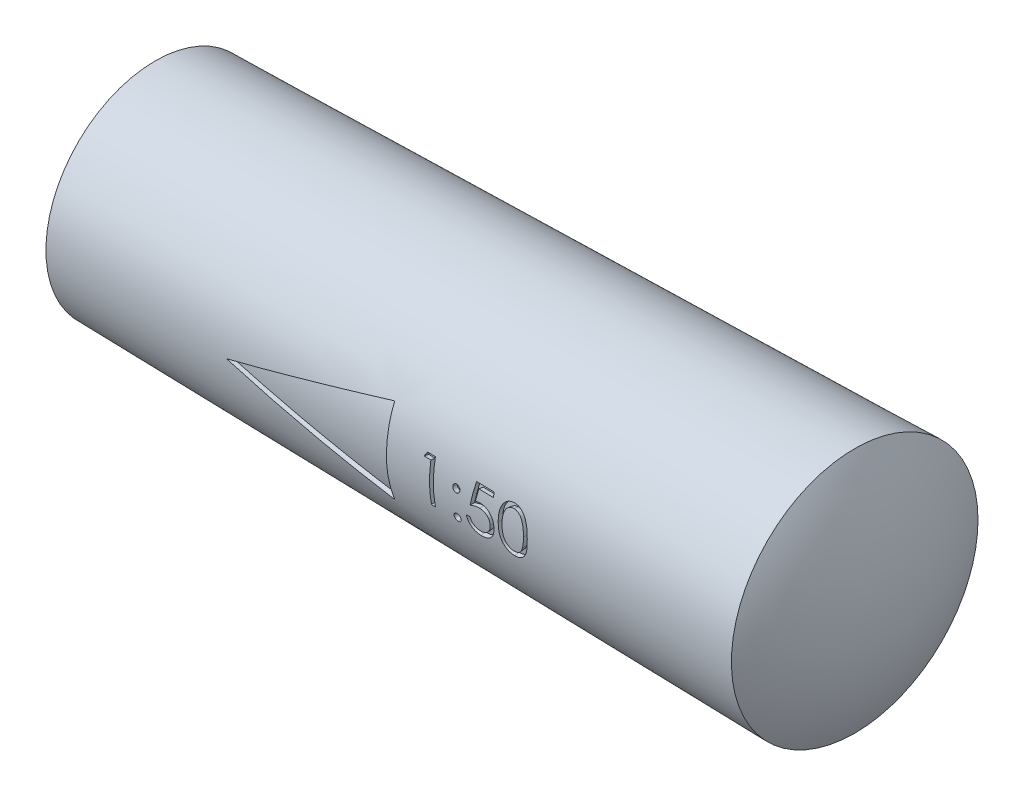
SolidWorks part; units mm, degrees
ref_plane "Front Plane" through (0, 0, 0) normal (0, 0, 1) x (1, 0, 0)
ref_plane "Top Plane" through (0, 0, 0) normal (0, 1, 0) x (1, 0, 0)
ref_plane "Right Plane" through (0, 0, 0) normal (1, 0, 0) x (0, 0, -1)
sketch "Sketch1" plane through (0, 0, 0) normal (1, 0, 0) x (0, 0, -1)
  circle A0 centre (0, 0) radius 2.5
  dimension "D1" = 5
extrude "Extrude1" add sketch "Sketch1" along normal mid plane 16
draft "Draft1" type of draft neutral plane draft angle 1.146 faces to draft 1 parameters "D1"=1.146
sketch "Sketch2" plane through (0, 0, 0) normal (0, 0, 1) x (1, 0, 0)
  line L0 (-8, 0) -> (-8, 2.5)
  line L1 (-8, 2.5) -> (-8, -2.5) construction
  line L2 (-8, 0) -> (-8.75, 0)
  line L3 (-8.75, 0) -> (-8.75, -2.66) construction
  line L4 (8, 0) -> (8, 2.82)
  line L5 (8, -2.82) -> (8, 2.82) construction
  line L6 (8, 0) -> (8.75, 0)
  line L7 (8.75, 0) -> (8.75, -2.66) construction
  line L8 (-8, -2.5) -> (8, -2.82) construction
  arc A0 (-8.75, 0) -> (-8, 2.5) centre (-4.2083, 0) cw
  arc A1 (8.75, 0) -> (8, 2.82) centre (3.0734, 0) ccw
  point P14 (0, -2.66)
revolve "Revolve1" add sketch "Sketch2" angle 360 about L2
sketch "Sketch5" plane through (0, 0, 0) normal (0, 0, 1) x (1, 0, 0)
  line L0 (0, 2.66) -> (0, -2.66) construction
  line L1 (8, 2.82) -> (-8, 2.5) construction
  line L2 (-8, -2.5) -> (8, -2.82) construction
ref_plane "Plane2" through (0, 0, 0) normal (-0.02, 0, 0.9998) x (0.9998, 0, 0.02)
sketch "Sketch6" plane through (0, 0, 0) normal (-0.02, 0, 0.9998) x (0.9998, 0, 0.02)
  line L0 (0, 0) -> (0, 1)
  line L1 (0, 2.66) -> (0, -2.66) construction
  line L2 (0, 1) -> (-3.7321, 0)
  line L3 (-3.7321, 0) -> (0, -1)
  line L4 (0, -1) -> (0, 0)
  line L5 (0, -0.5) -> (4, -0.5) construction
  text T0 "1:50" font "Century Gothic" height 1
  dimension "D1" = 2
  dimension "D2" = 30
  dimension "D3" = 4
wrap "Wrap2" sketch "Sketch6" wrap type deboss source sketch "Sketch6" thickness 0.1 parameters "D1"=0.1
equation "\"D2@Sketch2\" = \"D1@Sketch2\""
